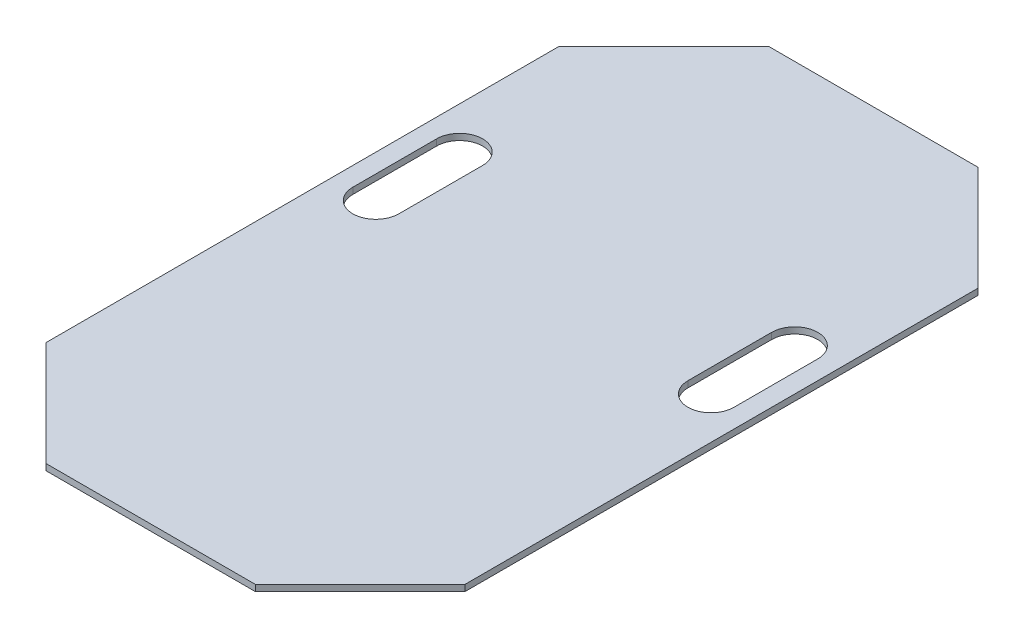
SolidWorks part; units mm, degrees
ref_plane "Face" through (0, 0, 0) normal (0, 0, 1) x (1, 0, 0)
ref_plane "Dessus" through (0, 0, 0) normal (0, 1, 0) x (1, 0, 0)
ref_plane "Droite" through (0, 0, 0) normal (1, 0, 0) x (0, 0, -1)
sketch "Esquisse1" plane through (0, 0, 0) normal (0, 1, 0) x (1, 0, 0)
  line L0 (0, 48.0043) -> (0, -48.7544) construction
  line L1 (-5, 3.6227) -> (5, 3.6227)
  line L2 (5, 3.6227) -> (10, -1.3773)
  line L3 (-5, 3.6227) -> (-10, -1.3773)
  line L4 (10, -1.3773) -> (10, -25.8773)
  line L5 (-10, -1.3773) -> (-10, -25.8773)
  line L6 (10, -25.8773) -> (5, -30.8773)
  line L7 (-10, -25.8773) -> (-5, -30.8773)
  line L8 (5, -30.8773) -> (-5, -30.8773)
  point P6 (0, 3.6227)
  point P13 (0, -30.8773)
  dimension "D1" = 20
  dimension "D2" = 34.5
  dimension "D3" = 5
  dimension "D4" = 5
  dimension "D5" = 5
  dimension "D6" = 5
extrude "Extrusion1" add sketch "Esquisse1" along normal blind 0.3
sketch "Esquisse2" plane through (0, 0.3, 0) normal (0, 1, 0) x (-1, 0, 0)
  line L0 (0, 0) -> (0, 17.8723) construction
  line L1 (-9.1, 8.1273) -> (-9.1, 12.1273)
  line L2 (-6.9, 8.1273) -> (-6.9, 12.1273)
  line L3 (6.9, 8.1273) -> (6.9, 12.1273)
  line L4 (9.1, 8.1273) -> (9.1, 12.1273)
  line L5 (-5, -3.6227) -> (5, -3.6227) construction
  arc A0 (-9.1, 8.1273) -> (-6.9, 8.1273) centre (-8, 8.1273) ccw
  arc A1 (9.1, 8.1273) -> (6.9, 8.1273) centre (8, 8.1273) cw
  arc A2 (-6.9, 12.1273) -> (-9.1, 12.1273) centre (-8, 12.1273) ccw
  arc A3 (6.9, 12.1273) -> (9.1, 12.1273) centre (8, 12.1273) cw
  dimension "D1" = 2.2
  dimension "D2" = 2.2
  dimension "D3" = 4
  dimension "D4" = 8
  dimension "D5" = 11.75
extrude "Enlèv. mat.-Extru.1" cut sketch "Esquisse2" against normal through all
